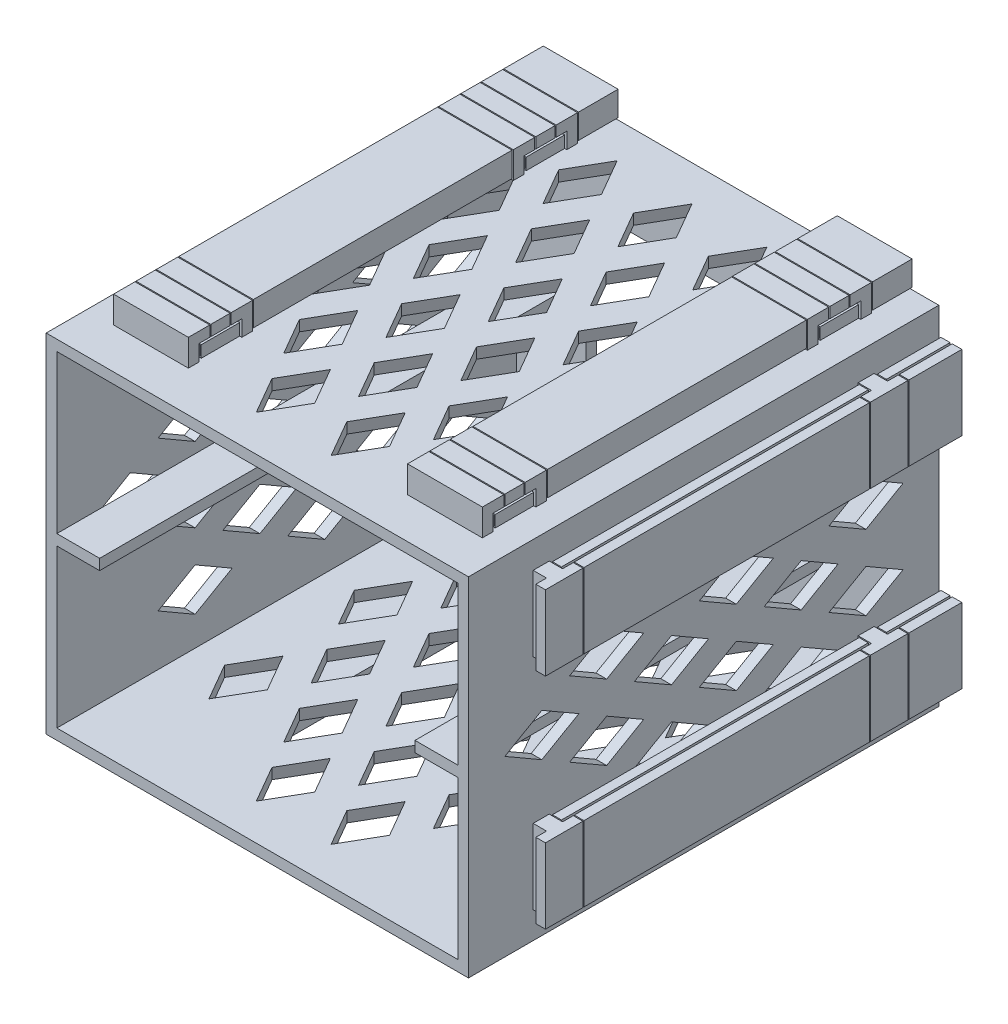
SolidWorks part; units mm, degrees
ref_plane "Alzado" through (0, 0, 0) normal (0, 0, 1) x (1, 0, 0)
ref_plane "Planta" through (0, 0, 0) normal (0, 1, 0) x (1, 0, 0)
ref_plane "Vista lateral" through (0, 0, 0) normal (1, 0, 0) x (0, 0, -1)
sketch "Croquis1" plane through (0, 0, 0) normal (0, 0, -1) x (-1, 0, 0)
  line L1 (-39.5, 32.5) -> (39.5, 32.5)
  line L2 (-39.5, 32.5) -> (-39.5, -32.5)
  line L3 (-39.5, -32.5) -> (39.5, -32.5)
  line L4 (39.5, 32.5) -> (39.5, -32.5)
  line L7 (-24.5, 17.5) -> (24.5, 17.5)
  line L8 (-24.5, 17.5) -> (-24.5, -17.5)
  line L9 (-24.5, -17.5) -> (24.5, -17.5)
  line L10 (24.5, 17.5) -> (24.5, -17.5)
extrude "Fondo" add sketch "Croquis1" against normal blind 2 separate body
sketch "Croquis3" plane through (0, 0, 2) normal (0, 0, 1) x (1, 0, 0)
  line L1 (-39.5, 32.5) -> (39.5, 32.5)
  line L2 (-39.5, 32.5) -> (-39.5, -32.5)
  line L3 (-39.5, -32.5) -> (39.5, -32.5)
  line L4 (39.5, 32.5) -> (39.5, -32.5)
  line L6 (-37.5, 30.5) -> (-37.5, -30.5)
  line L7 (-37.5, 30.5) -> (37.5, 30.5)
  line L8 (37.5, 30.5) -> (37.5, -30.5)
  line L9 (-37.5, -30.5) -> (37.5, -30.5)
extrude "Estructura" add sketch "Croquis3" along normal blind 86
sketch "Croquis5" plane through (-39.5, 0, 0) normal (-1, 0, 0) x (0, 0, 1)
  line L0 (13.628, 25) -> (20.556, 21)
  line L1 (20.556, 21) -> (13.628, 17)
  line L2 (13.628, 17) -> (6.7, 21)
  line L3 (6.7, 21) -> (13.628, 25)
  line L4 (0, -32.5) -> (0, 32.5) construction
  line L5 (88, 32.5) -> (0, 32.5) construction
  line L6 (13.628, 11) -> (20.556, 7)
  line L7 (6.7, 7) -> (13.628, 11)
  line L8 (13.628, 3) -> (6.7, 7)
  line L9 (20.556, 7) -> (13.628, 3)
  line L10 (13.628, -3) -> (20.556, -7)
  line L11 (6.7, -7) -> (13.628, -3)
  line L12 (13.628, -11) -> (6.7, -7)
  line L13 (20.556, -7) -> (13.628, -11)
  line L14 (13.628, -17) -> (20.556, -21)
  line L15 (6.7, -21) -> (13.628, -17)
  line L16 (13.628, -25) -> (6.7, -21)
  line L17 (20.556, -21) -> (13.628, -25)
  line L18 (37.884, 25) -> (44.812, 21)
  line L19 (44.812, 21) -> (37.884, 17)
  line L20 (37.884, 17) -> (30.956, 21)
  line L21 (30.956, 21) -> (37.884, 25)
  line L22 (44.812, 7) -> (37.884, 3)
  line L23 (37.884, 11) -> (44.812, 7)
  line L24 (30.956, 7) -> (37.884, 11)
  line L25 (37.884, 3) -> (30.956, 7)
  line L26 (44.812, -7) -> (37.884, -11)
  line L27 (37.884, -3) -> (44.812, -7)
  line L28 (30.956, -7) -> (37.884, -3)
  line L29 (37.884, -11) -> (30.956, -7)
  line L30 (37.884, -17) -> (44.812, -21)
  line L31 (44.812, -21) -> (37.884, -25)
  line L32 (37.884, -25) -> (30.956, -21)
  line L33 (30.956, -21) -> (37.884, -17)
  line L34 (62.14, 25) -> (69.068, 21)
  line L35 (69.068, 21) -> (62.14, 17)
  line L36 (62.14, 17) -> (55.212, 21)
  line L37 (55.212, 21) -> (62.14, 25)
  line L38 (69.068, 7) -> (62.14, 3)
  line L39 (62.14, 11) -> (69.068, 7)
  line L40 (55.212, 7) -> (62.14, 11)
  line L41 (62.14, 3) -> (55.212, 7)
  line L42 (69.068, -7) -> (62.14, -11)
  line L43 (62.14, -3) -> (69.068, -7)
  line L44 (55.212, -7) -> (62.14, -3)
  line L45 (62.14, -11) -> (55.212, -7)
  line L46 (62.14, -17) -> (69.068, -21)
  line L47 (69.068, -21) -> (62.14, -25)
  line L48 (62.14, -25) -> (55.212, -21)
  line L49 (55.212, -21) -> (62.14, -17)
  line L66 (50.012, 18) -> (56.94, 14)
  line L67 (56.94, 14) -> (50.012, 10)
  line L68 (50.012, 10) -> (43.084, 14)
  line L69 (43.084, 14) -> (50.012, 18)
  line L70 (50.012, 4) -> (56.94, 0)
  line L71 (43.084, 0) -> (50.012, 4)
  line L72 (50.012, -4) -> (43.084, 0)
  line L73 (56.94, -14) -> (50.012, -18)
  line L74 (50.012, -10) -> (56.94, -14)
  line L75 (43.084, -14) -> (50.012, -10)
  line L76 (18.828, 14) -> (25.756, 18)
  line L77 (67.34, 14) -> (74.268, 18) construction
  line L78 (67.34, -14) -> (74.268, -10) construction
  line L79 (74.268, -18) -> (67.34, -14) construction
  line L80 (25.756, 4) -> (32.684, 0)
  line L81 (18.828, 0) -> (25.756, 4)
  line L82 (25.756, -4) -> (18.828, 0)
  line L83 (32.684, 0) -> (25.756, -4)
  line L84 (25.756, -18) -> (18.828, -14)
  line L85 (32.684, -14) -> (25.756, -18)
  line L86 (56.94, 0) -> (50.012, -4)
  line L87 (50.012, -18) -> (43.084, -14)
  line L88 (32.684, 14) -> (25.756, 10)
  line L89 (25.756, 10) -> (18.828, 14)
  line L90 (25.756, 18) -> (32.684, 14)
  line L91 (74.268, 18) -> (81.196, 14) construction
  line L92 (81.196, 14) -> (74.268, 10) construction
  line L93 (74.268, 10) -> (67.34, 14) construction
  line L94 (81.196, 0) -> (74.268, -4)
  line L95 (74.268, 4) -> (81.196, 0)
  line L96 (67.34, 0) -> (74.268, 4)
  line L97 (74.268, -4) -> (67.34, 0)
  line L98 (81.196, -14) -> (74.268, -18) construction
  line L99 (74.268, -10) -> (81.196, -14) construction
  line L100 (25.756, -10) -> (32.684, -14)
  line L101 (18.828, -14) -> (25.756, -10)
  line L102 (88, 32.5) -> (0, 32.5) construction
  line L103 (86.396, 25) -> (93.324, 21)
  line L104 (93.324, 21) -> (86.396, 17)
  line L105 (86.396, 17) -> (79.468, 21)
  line L106 (79.468, 21) -> (86.396, 25)
  line L107 (93.324, 7) -> (86.396, 3)
  line L108 (86.396, 11) -> (93.324, 7)
  line L109 (79.468, 7) -> (86.396, 11)
  line L110 (86.396, 3) -> (79.468, 7)
  line L111 (93.324, -7) -> (86.396, -11)
  line L112 (86.396, -3) -> (93.324, -7)
  line L113 (79.468, -7) -> (86.396, -3)
  line L114 (86.396, -11) -> (79.468, -7)
  line L115 (86.396, -17) -> (93.324, -21)
  line L116 (93.324, -21) -> (86.396, -25)
  line L117 (86.396, -25) -> (79.468, -21)
  line L118 (79.468, -21) -> (86.396, -17)
  dimension "D1" = 7.9998
  dimension "D2" = 7.9998
  dimension "D3" = 6.7
  dimension "D4" = 7.5
  dimension "D5" = 8
  dimension "D7" = 13.856
  dimension "D9" = 24.256
  dimension "D10" = 14.5
  dimension "D11" = 24.256
  dimension "D6" = 4
  dimension "D8" = 4
extrude "RombosHor" cut sketch "Croquis5" against normal up to surface (79 mm away)
sketch "Croquis9" plane through (0, 32.5, 0) normal (0, 1, 0) x (1, 0, 0)
  line L0 (28, -6.6872) -> (24, -13.6154)
  line L1 (28, -6.6872) -> (32, -13.6154)
  line L2 (24, -13.6154) -> (28, -20.5436)
  line L3 (32, -13.6154) -> (28, -20.5436)
  line L4 (14, -6.6872) -> (10, -13.6154)
  line L5 (14, -6.6872) -> (18, -13.6154)
  line L6 (18, -13.6154) -> (14, -20.5436)
  line L7 (10, -13.6154) -> (14, -20.5436)
  line L8 (0, -6.6872) -> (-4, -13.6154)
  line L9 (0, -6.6872) -> (4, -13.6154)
  line L10 (4, -13.6154) -> (0, -20.5436)
  line L11 (-4, -13.6154) -> (0, -20.5436)
  line L12 (-14, -6.6872) -> (-18, -13.6154)
  line L13 (-14, -6.6872) -> (-10, -13.6154)
  line L14 (-10, -13.6154) -> (-14, -20.5436)
  line L15 (-18, -13.6154) -> (-14, -20.5436)
  line L16 (-28, -6.6872) -> (-32, -13.6154)
  line L17 (-28, -6.6872) -> (-24, -13.6154)
  line L18 (-24, -13.6154) -> (-28, -20.5436)
  line L19 (-32, -13.6154) -> (-28, -20.5436)
  line L20 (14, -30.9436) -> (10, -37.8718)
  line L21 (14, -30.9436) -> (18, -37.8718)
  line L22 (18, -37.8718) -> (14, -44.8)
  line L23 (10, -37.8718) -> (14, -44.8)
  line L24 (0, -30.9436) -> (-4, -37.8718)
  line L25 (0, -30.9436) -> (4, -37.8718)
  line L26 (4, -37.8718) -> (0, -44.8)
  line L27 (-4, -37.8718) -> (0, -44.8)
  line L28 (-14, -30.9436) -> (-18, -37.8718)
  line L29 (-14, -30.9436) -> (-10, -37.8718)
  line L30 (-10, -37.8718) -> (-14, -44.8)
  line L31 (-18, -37.8718) -> (-14, -44.8)
  line L32 (-28, -30.9436) -> (-32, -37.8718)
  line L33 (-28, -30.9436) -> (-24, -37.8718)
  line L34 (-24, -37.8718) -> (-28, -44.8)
  line L35 (-32, -37.8718) -> (-28, -44.8)
  line L36 (14, -55.2) -> (10, -62.1282)
  line L37 (14, -55.2) -> (18, -62.1282)
  line L38 (18, -62.1282) -> (14, -69.0564)
  line L39 (10, -62.1282) -> (14, -69.0564)
  line L40 (0, -55.2) -> (-4, -62.1282)
  line L41 (0, -55.2) -> (4, -62.1282)
  line L42 (4, -62.1282) -> (0, -69.0564)
  line L43 (-4, -62.1282) -> (0, -69.0564)
  line L44 (-14, -55.2) -> (-18, -62.1282)
  line L45 (-14, -55.2) -> (-10, -62.1282)
  line L46 (-10, -62.1282) -> (-14, -69.0564)
  line L47 (-18, -62.1282) -> (-14, -69.0564)
  line L48 (-28, -55.2) -> (-32, -62.1282)
  line L49 (-28, -55.2) -> (-24, -62.1282)
  line L50 (-24, -62.1282) -> (-28, -69.0564)
  line L51 (-32, -62.1282) -> (-28, -69.0564)
  line L68 (28, -30.9436) -> (24, -37.8718)
  line L69 (28, -30.9436) -> (32, -37.8718)
  line L70 (32, -37.8718) -> (28, -44.8)
  line L71 (24, -37.8718) -> (28, -44.8)
  line L72 (28, -55.2) -> (24, -62.1282)
  line L73 (28, -55.2) -> (32, -62.1282)
  line L74 (32, -62.1282) -> (28, -69.0564)
  line L75 (24, -62.1282) -> (28, -69.0564)
  line L80 (28, -6.6872) -> (14, -6.6872) construction
  line L81 (28, -6.6872) -> (28, -30.9436) construction
  line L83 (39.5, -88) -> (39.5, 0) construction
  line L87 (-39.5, 0) -> (39.5, 0) construction
  line L88 (17, -50.0018) -> (21, -56.93)
  line L89 (7, -67.33) -> (11, -74.2582)
  line L90 (-7, -67.33) -> (-11, -74.2582)
  line L91 (-7, -67.33) -> (-3, -74.2582)
  line L92 (-3, -74.2582) -> (-7, -81.1864)
  line L93 (-21, -67.33) -> (-25, -74.2582) construction
  line L94 (-21, -67.33) -> (-17, -74.2582) construction
  line L95 (-25, -74.2582) -> (-21, -81.1864) construction
  line L96 (21, -67.33) -> (25, -74.2582) construction
  line L97 (25, -74.2582) -> (21, -81.1864) construction
  line L98 (17, -74.2582) -> (21, -81.1864) construction
  line L99 (7, -18.8172) -> (3, -25.7454)
  line L100 (17, -25.7454) -> (21, -32.6736)
  line L101 (21, -18.8172) -> (25, -25.7454)
  line L102 (-7, -43.0736) -> (-11, -50.0018)
  line L103 (-3, -50.0018) -> (-7, -56.93)
  line L104 (-21, -43.0736) -> (-25, -50.0018)
  line L105 (-21, -43.0736) -> (-17, -50.0018)
  line L106 (-3, -25.7454) -> (-7, -32.6736)
  line L107 (-11, -25.7454) -> (-7, -32.6736)
  line L108 (-21, -18.8172) -> (-17, -25.7454)
  line L109 (-21, -18.8172) -> (-25, -25.7454)
  line L110 (-25, -25.7454) -> (-21, -32.6736)
  line L111 (21, -43.0736) -> (17, -50.0018)
  line L112 (11, -25.7454) -> (7, -32.6736)
  line L113 (7, -18.8172) -> (11, -25.7454)
  line L114 (7, -67.33) -> (3, -74.2582)
  line L115 (11, -74.2582) -> (7, -81.1864)
  line L116 (3, -74.2582) -> (7, -81.1864)
  line L117 (-11, -74.2582) -> (-7, -81.1864)
  line L118 (-17, -74.2582) -> (-21, -81.1864) construction
  line L119 (21, -67.33) -> (17, -74.2582) construction
  line L120 (7, -43.0736) -> (3, -50.0018)
  line L121 (7, -43.0736) -> (11, -50.0018)
  line L122 (11, -50.0018) -> (7, -56.93)
  line L123 (3, -50.0018) -> (7, -56.93)
  line L124 (21, -43.0736) -> (25, -50.0018)
  line L125 (25, -50.0018) -> (21, -56.93)
  line L126 (21, -18.8172) -> (17, -25.7454)
  line L127 (-7, -43.0736) -> (-3, -50.0018)
  line L128 (-11, -50.0018) -> (-7, -56.93)
  line L129 (-17, -50.0018) -> (-21, -56.93)
  line L130 (-25, -50.0018) -> (-21, -56.93)
  line L131 (-7, -18.8172) -> (-11, -25.7454)
  line L132 (-7, -18.8172) -> (-3, -25.7454)
  line L133 (-17, -25.7454) -> (-21, -32.6736)
  line L134 (3, -25.7454) -> (7, -32.6736)
  line L135 (25, -25.7454) -> (21, -32.6736)
  line L136 (18, -86.3846) -> (14, -93.3128)
  line L137 (10, -86.3846) -> (14, -93.3128)
  line L138 (4, -86.3846) -> (0, -93.3128)
  line L139 (-4, -86.3846) -> (0, -93.3128)
  line L140 (-10, -86.3846) -> (-14, -93.3128)
  line L141 (-18, -86.3846) -> (-14, -93.3128)
  line L142 (-24, -86.3846) -> (-28, -93.3128)
  line L143 (-32, -86.3846) -> (-28, -93.3128)
  line L144 (32, -86.3846) -> (28, -93.3128)
  line L145 (24, -86.3846) -> (28, -93.3128)
  line L146 (14, -79.4564) -> (10, -86.3846)
  line L147 (14, -79.4564) -> (18, -86.3846)
  line L148 (0, -79.4564) -> (-4, -86.3846)
  line L149 (0, -79.4564) -> (4, -86.3846)
  line L150 (-14, -79.4564) -> (-18, -86.3846)
  line L151 (-14, -79.4564) -> (-10, -86.3846)
  line L152 (-28, -79.4564) -> (-32, -86.3846)
  line L153 (-28, -79.4564) -> (-24, -86.3846)
  line L154 (28, -79.4564) -> (24, -86.3846)
  line L155 (28, -79.4564) -> (32, -86.3846)
  dimension "D1" = 8
  dimension "D2" = 8
  dimension "D3" = 8
  dimension "D4" = 13.8564
  dimension "D7" = 14
  dimension "D8" = 24.2564
  dimension "D9" = 6.6872
  dimension "D10" = 7.5
  dimension "D5" = 5
  dimension "D6" = 4
extrude "RombosVert" cut sketch "Croquis9" against normal up to surface (65 mm away)
sketch "Croquis8" plane through (0, 0, 2) normal (0, 0, 1) x (1, 0, 0)
  line L0 (-37.5, -30.5) -> (37.5, -30.5) construction
  line L1 (-29.5, -1) -> (-37.5, -1)
  line L2 (-29.5, -1) -> (-29.5, 1)
  line L3 (-29.5, 1) -> (-37.5, 1)
  line L4 (-37.5, -1) -> (-37.5, 1)
  line L5 (29.5, 1) -> (37.5, 1)
  line L6 (29.5, 1) -> (29.5, -1)
  line L7 (29.5, -1) -> (37.5, -1)
  line L8 (37.5, 1) -> (37.5, -1)
  dimension "D1" = 8
  dimension "D2" = 2
  dimension "D3" = 29.5
extrude "Guias" add sketch "Croquis8" along normal blind 86
sketch "Croquis10" plane through (39.5, 0, 0) normal (1, 0, 0) x (0, 0, -1)
  line L0 (-88, 32.5) -> (0, 32.5) construction
  line L1 (-12.104, -27.5) -> (-12.104, -13.5)
  line L2 (-15.104, -13.5) -> (-12.104, -13.5)
  line L3 (-15.104, -27.5) -> (-15.104, -13.5)
  line L4 (-15.104, -27.5) -> (-12.104, -27.5)
  line L5 (-88, 0) -> (0, 0) construction
  line L6 (-75.896, 27.5) -> (-75.896, 13.5)
  line L7 (-72.896, 13.5) -> (-75.896, 13.5)
  line L8 (-72.896, 27.5) -> (-72.896, 13.5)
  line L9 (0, 32.5) -> (0, -32.5) construction
  line L11 (-44, -32.5) -> (-44, 32.5) construction
  line L12 (-15.104, 27.5) -> (-12.104, 27.5)
  line L13 (-15.104, 27.5) -> (-15.104, 13.5)
  line L14 (-15.104, 13.5) -> (-12.104, 13.5)
  line L15 (-12.104, 27.5) -> (-12.104, 13.5)
  line L16 (-72.896, 27.5) -> (-75.896, 27.5)
  line L17 (-72.896, -27.5) -> (-75.896, -27.5)
  line L18 (-72.896, -27.5) -> (-72.896, -13.5)
  line L19 (-72.896, -13.5) -> (-75.896, -13.5)
  line L20 (-75.896, -27.5) -> (-75.896, -13.5)
  line L21 (-88, -32.5) -> (0, -32.5) construction
  dimension "D1" = 44
  dimension "D2" = 32.5
  dimension "D6" = 3
  dimension "D7" = 14
  dimension "D8" = 5
  dimension "D9" = 12.104
extrude "AncDer01" add sketch "Croquis10" along normal blind 2.5
sketch "Croquis11" plane through (42, 0, 0) normal (1, 0, 0) x (0, 0, -1)
  line L0 (-15.104, 13.5) -> (-12.104, 13.5) construction
  line L1 (0, 32.5) -> (0, -32.5) construction
  line L2 (-15.104, 27.5) -> (-15.104, 24.1478) construction
  line L3 (-17.104, 27.5) -> (-10.104, 27.5)
  line L4 (-17.104, 27.5) -> (-17.104, 13.5)
  line L5 (-44, 32.5) -> (-44, -32.5) construction
  line L6 (-12.104, 27.5) -> (-15.104, 27.5) construction
  line L7 (-10.104, -27.5) -> (-10.104, -13.5)
  line L8 (-17.104, 13.5) -> (-10.104, 13.5)
  line L9 (-17.104, -13.5) -> (-10.104, -13.5)
  line L10 (-88, 0) -> (0, 0) construction
  line L11 (-10.104, 27.5) -> (-10.104, 13.5)
  line L12 (-17.104, -27.5) -> (-17.104, -13.5)
  line L13 (-17.104, -27.5) -> (-10.104, -27.5)
  line L14 (-70.896, -27.5) -> (-77.896, -27.5)
  line L15 (-70.896, -27.5) -> (-70.896, -13.5)
  line L16 (-77.896, 27.5) -> (-77.896, 13.5)
  line L17 (-70.896, -13.5) -> (-77.896, -13.5)
  line L18 (-70.896, 13.5) -> (-77.896, 13.5)
  line L19 (-77.896, -27.5) -> (-77.896, -13.5)
  line L20 (-70.896, 27.5) -> (-70.896, 13.5)
  line L21 (-70.896, 27.5) -> (-77.896, 27.5)
  dimension "D1" = 44
  dimension "D2" = 88
  dimension "D3" = 7
  dimension "D4" = 2
extrude "AncDer02" add sketch "Croquis11" along normal blind 1.8
sketch "Croquis12" plane through (0, 32.5, 0) normal (0, 1, 0) x (1, 0, 0)
  line L1 (20.5, -9.604) -> (20.5, -7.604)
  line L2 (34.5, -7.604) -> (20.5, -7.604)
  line L3 (34.5, -9.604) -> (34.5, -7.604)
  line L4 (34.5, -9.604) -> (20.5, -9.604)
  line L5 (20.5, -19.604) -> (20.5, -17.604)
  line L6 (34.5, -17.604) -> (20.5, -17.604)
  line L7 (34.5, -19.604) -> (34.5, -17.604)
  line L8 (34.5, -19.604) -> (20.5, -19.604)
  line L10 (39.5, -44) -> (-39.5, -44) construction
  line L11 (-20.5, -78.396) -> (-20.5, -80.396)
  line L12 (-34.5, -80.396) -> (-20.5, -80.396)
  line L13 (0, -88) -> (0, 0) construction
  line L14 (-34.5, -78.396) -> (-34.5, -80.396)
  line L15 (-34.5, -78.396) -> (-20.5, -78.396)
  line L16 (-20.5, -68.396) -> (-20.5, -70.396)
  line L17 (-34.5, -70.396) -> (-20.5, -70.396)
  line L18 (-34.5, -68.396) -> (-34.5, -70.396)
  line L19 (-34.5, -68.396) -> (-20.5, -68.396)
  line L20 (34.5, -68.396) -> (20.5, -68.396)
  line L21 (-34.5, -19.604) -> (-20.5, -19.604)
  line L22 (-34.5, -19.604) -> (-34.5, -17.604)
  line L23 (-34.5, -17.604) -> (-20.5, -17.604)
  line L24 (-20.5, -19.604) -> (-20.5, -17.604)
  line L25 (-34.5, -9.604) -> (-20.5, -9.604)
  line L26 (-34.5, -9.604) -> (-34.5, -7.604)
  line L27 (-34.5, -7.604) -> (-20.5, -7.604)
  line L28 (-20.5, -9.604) -> (-20.5, -7.604)
  line L29 (34.5, -68.396) -> (34.5, -70.396)
  line L30 (34.5, -70.396) -> (20.5, -70.396)
  line L31 (20.5, -68.396) -> (20.5, -70.396)
  line L32 (34.5, -78.396) -> (20.5, -78.396)
  line L33 (34.5, -78.396) -> (34.5, -80.396)
  line L34 (34.5, -80.396) -> (20.5, -80.396)
  line L35 (20.5, -78.396) -> (20.5, -80.396)
  line L38 (-39.5, 0) -> (39.5, 0) construction
  line L39 (-39.5, -88) -> (-39.5, 0) construction
  dimension "D9" = 88
  dimension "D10" = 44
  dimension "D11" = 2
  dimension "D12" = 2
  dimension "D13" = 14
  dimension "D14" = 14
  dimension "D15" = 5
  dimension "D16" = 5
  dimension "D17" = 7.604
  dimension "D18" = 8
extrude "AncSup01" add sketch "Croquis12" along normal blind 3
sketch "Croquis13" plane through (0, 35.5, 0) normal (0, 1, 0) x (1, 0, 0)
  line L0 (39.5, -44) -> (-39.5, -44) construction
  line L2 (-39.5, 0) -> (39.5, 0) construction
  line L3 (-20.5, -9.604) -> (-20.5, -7.604) construction
  line L4 (-34.5, -7.604) -> (-20.5, -7.604)
  line L5 (-34.5, -7.604) -> (-34.5, -11.604)
  line L6 (-34.5, -11.604) -> (-20.5, -11.604)
  line L7 (-20.5, -7.604) -> (-20.5, -11.604)
  line L8 (-27.4575, -19.604) -> (-21.4543, -19.604) construction
  line L10 (-34.5, -19.604) -> (-20.5, -19.604)
  line L11 (0, 0) -> (0, -88) construction
  line L13 (-34.5, -19.604) -> (-34.5, -15.604)
  line L14 (-34.5, -15.604) -> (-20.5, -15.604)
  line L15 (-20.5, -19.604) -> (-20.5, -15.604)
  line L16 (-20.5, -19.604) -> (-20.5, -17.604) construction
  line L17 (20.5, -19.604) -> (20.5, -15.604)
  line L18 (34.5, -15.604) -> (20.5, -15.604)
  line L19 (34.5, -19.604) -> (34.5, -15.604)
  line L20 (34.5, -19.604) -> (20.5, -19.604)
  line L21 (20.5, -7.604) -> (20.5, -11.604)
  line L22 (34.5, -11.604) -> (20.5, -11.604)
  line L23 (34.5, -7.604) -> (34.5, -11.604)
  line L24 (34.5, -7.604) -> (20.5, -7.604)
  line L25 (34.5, -80.396) -> (20.5, -80.396)
  line L26 (34.5, -80.396) -> (34.5, -76.396)
  line L27 (34.5, -76.396) -> (20.5, -76.396)
  line L28 (20.5, -80.396) -> (20.5, -76.396)
  line L29 (34.5, -68.396) -> (20.5, -68.396)
  line L30 (34.5, -68.396) -> (34.5, -72.396)
  line L31 (34.5, -72.396) -> (20.5, -72.396)
  line L32 (20.5, -68.396) -> (20.5, -72.396)
  line L33 (-20.5, -68.396) -> (-20.5, -72.396)
  line L34 (-34.5, -72.396) -> (-20.5, -72.396)
  line L35 (-34.5, -68.396) -> (-34.5, -72.396)
  line L36 (-34.5, -68.396) -> (-20.5, -68.396)
  line L37 (-20.5, -80.396) -> (-20.5, -76.396)
  line L38 (-34.5, -76.396) -> (-20.5, -76.396)
  line L39 (-34.5, -80.396) -> (-34.5, -76.396)
  line L40 (-34.5, -80.396) -> (-20.5, -80.396)
  dimension "D1" = 44
  dimension "D2" = 88
  dimension "D3" = 4
  dimension "D4" = 4
extrude "AncSup02" add sketch "Croquis13" along normal blind 2
sketch "Croquis52" plane through (-39.5, 0, 0) normal (-1, 0, 0) x (0, 0, 1)
  line L0 (0, -32.5) -> (0, 32.5) construction
  line L1 (88, 32.5) -> (0, 32.5) construction
  line L2 (9.604, -27.5) -> (7.604, -27.5)
  line L3 (9.604, -27.5) -> (9.604, -13.5)
  line L4 (9.604, -13.5) -> (7.604, -13.5)
  line L5 (7.604, -27.5) -> (7.604, -13.5)
  line L6 (19.604, -27.5) -> (17.604, -27.5)
  line L7 (19.604, -27.5) -> (19.604, -13.5)
  line L8 (19.604, -13.5) -> (17.604, -13.5)
  line L9 (44, 32.5) -> (44, -32.5) construction
  line L10 (17.604, -27.5) -> (17.604, -13.5)
  line L11 (78.396, 27.5) -> (80.396, 27.5)
  line L12 (78.396, 27.5) -> (78.396, 13.5)
  line L13 (78.396, 13.5) -> (80.396, 13.5)
  line L14 (80.396, 27.5) -> (80.396, 13.5)
  line L15 (68.396, 27.5) -> (70.396, 27.5)
  line L16 (88, 0) -> (0, 0) construction
  line L17 (68.396, 27.5) -> (68.396, 13.5)
  line L18 (68.396, 13.5) -> (70.396, 13.5)
  line L19 (70.396, 27.5) -> (70.396, 13.5)
  line L20 (70.396, -27.5) -> (70.396, -13.5)
  line L21 (68.396, -13.5) -> (70.396, -13.5)
  line L22 (68.396, -27.5) -> (68.396, -13.5)
  line L23 (68.396, -27.5) -> (70.396, -27.5)
  line L24 (80.396, -27.5) -> (80.396, -13.5)
  line L25 (78.396, -13.5) -> (80.396, -13.5)
  line L26 (78.396, -27.5) -> (78.396, -13.5)
  line L27 (78.396, -27.5) -> (80.396, -27.5)
  line L32 (17.604, 27.5) -> (17.604, 13.5)
  line L33 (19.604, 13.5) -> (17.604, 13.5)
  line L34 (19.604, 27.5) -> (19.604, 13.5)
  line L35 (19.604, 27.5) -> (17.604, 27.5)
  line L36 (7.604, 27.5) -> (7.604, 13.5)
  line L37 (9.604, 13.5) -> (7.604, 13.5)
  line L38 (9.604, 27.5) -> (9.604, 13.5)
  line L39 (9.604, 27.5) -> (7.604, 27.5)
  dimension "D1" = 44
  dimension "D2" = 88
  dimension "D3" = 2
  dimension "D4" = 2
  dimension "D5" = 8
  dimension "D6" = 14
  dimension "D7" = 14
  dimension "D8" = 7.604
  dimension "D9" = 5
  dimension "D10" = 5
extrude "AncIzq01" [suppressed] add sketch "Croquis52" along normal blind 3
sketch "Croquis53" [suppressed] plane through (-42.5, 0, 0) normal (-1, 0, 0) x (0, 0, 1)
  line L0 (44, 32.5) -> (44, -32.5) construction
  line L1 (0, -32.5) -> (0, 32.5) construction
  line L2 (7.604, 13.5) -> (9.604, 13.5) construction
  line L3 (7.604, 27.5) -> (11.604, 27.5)
  line L4 (7.604, 27.5) -> (7.604, 13.5)
  line L5 (7.604, 13.5) -> (11.604, 13.5)
  line L6 (11.604, 27.5) -> (11.604, 13.5)
  line L7 (17.604, 13.5) -> (19.604, 13.5) construction
  line L8 (19.604, 27.5) -> (15.604, 27.5)
  line L10 (19.604, 27.5) -> (19.604, 13.5)
  line L12 (88, 0) -> (0, 0) construction
  line L13 (19.604, 13.5) -> (15.604, 13.5)
  line L14 (15.604, 27.5) -> (15.604, 13.5)
  line L15 (15.604, -27.5) -> (15.604, -13.5)
  line L16 (19.604, -13.5) -> (15.604, -13.5)
  line L17 (19.604, -27.5) -> (19.604, -13.5)
  line L18 (19.604, -27.5) -> (15.604, -27.5)
  line L19 (11.604, -27.5) -> (11.604, -13.5)
  line L20 (7.604, -13.5) -> (11.604, -13.5)
  line L21 (7.604, -27.5) -> (7.604, -13.5)
  line L22 (7.604, -27.5) -> (11.604, -27.5)
  line L23 (80.396, -27.5) -> (76.396, -27.5)
  line L24 (80.396, -27.5) -> (80.396, -13.5)
  line L25 (80.396, -13.5) -> (76.396, -13.5)
  line L26 (76.396, -27.5) -> (76.396, -13.5)
  line L27 (68.396, -27.5) -> (72.396, -27.5)
  line L28 (68.396, -27.5) -> (68.396, -13.5)
  line L29 (68.396, -13.5) -> (72.396, -13.5)
  line L30 (72.396, -27.5) -> (72.396, -13.5)
  line L31 (72.396, 27.5) -> (72.396, 13.5)
  line L32 (68.396, 13.5) -> (72.396, 13.5)
  line L33 (68.396, 27.5) -> (68.396, 13.5)
  line L34 (68.396, 27.5) -> (72.396, 27.5)
  line L35 (76.396, 27.5) -> (76.396, 13.5)
  line L36 (80.396, 13.5) -> (76.396, 13.5)
  line L37 (80.396, 27.5) -> (80.396, 13.5)
  line L38 (80.396, 27.5) -> (76.396, 27.5)
  dimension "D1" = 44
  dimension "D2" = 88
  dimension "D3" = 4
  dimension "D4" = 4
extrude "AncIzq02" [suppressed] add sketch "Croquis53" along normal blind 2
sketch "Croquis54" plane through (0, -32.5, 0) normal (0, -1, 0) x (1, 0, 0)
  line L0 (0, 88) -> (0, 0) construction
  line L1 (-34.5, 15.104) -> (-20.5, 15.104)
  line L2 (-34.5, 15.104) -> (-34.5, 12.104)
  line L3 (-34.5, 12.104) -> (-20.5, 12.104)
  line L4 (-20.5, 15.104) -> (-20.5, 12.104)
  line L5 (-39.5, 88) -> (39.5, 88) construction
  line L6 (-39.5, 44) -> (39.5, 44) construction
  line L7 (-39.5, 88) -> (-39.5, 0) construction
  line L8 (39.5, 88) -> (39.5, 0) construction
  line L9 (39.5, 0) -> (-39.5, 0) construction
  line L10 (20.5, 15.104) -> (20.5, 12.104)
  line L11 (34.5, 12.104) -> (20.5, 12.104)
  line L12 (34.5, 15.104) -> (34.5, 12.104)
  line L13 (34.5, 15.104) -> (20.5, 15.104)
  line L14 (34.5, 72.896) -> (20.5, 72.896)
  line L15 (34.5, 72.896) -> (34.5, 75.896)
  line L16 (34.5, 75.896) -> (20.5, 75.896)
  line L17 (20.5, 72.896) -> (20.5, 75.896)
  line L18 (-20.5, 72.896) -> (-20.5, 75.896)
  line L19 (-34.5, 75.896) -> (-20.5, 75.896)
  line L20 (-34.5, 72.896) -> (-34.5, 75.896)
  line L21 (-34.5, 72.896) -> (-20.5, 72.896)
  dimension "D1" = 3
  dimension "D2" = 14
  dimension "D3" = 5
  dimension "D4" = 12.104
extrude "AncInf01" add sketch "Croquis54" along normal blind 2.5
sketch "Croquis55" plane through (0, -35, 0) normal (0, -1, 0) x (1, 0, 0)
  line L1 (-34.5, 77.896) -> (-20.5, 77.896)
  line L2 (-34.5, 77.896) -> (-34.5, 70.896)
  line L3 (-34.5, 70.896) -> (-20.5, 70.896)
  line L4 (-20.5, 77.896) -> (-20.5, 70.896)
  line L6 (-20.5, 72.896) -> (-20.5, 75.896) construction
  line L7 (-34.5, 75.896) -> (-34.5, 72.896) construction
  line L8 (-34.5, 72.896) -> (-20.5, 72.896) construction
  line L9 (-39.5, 44) -> (39.5, 44) construction
  line L10 (-39.5, 88) -> (-39.5, 0) construction
  line L11 (39.5, 88) -> (39.5, 0) construction
  line L12 (0, 88) -> (0, 0) construction
  line L13 (-39.5, 88) -> (39.5, 88) construction
  line L14 (20.5, 77.896) -> (20.5, 70.896)
  line L15 (34.5, 70.896) -> (20.5, 70.896)
  line L16 (34.5, 77.896) -> (34.5, 70.896)
  line L17 (34.5, 77.896) -> (20.5, 77.896)
  line L18 (34.5, 10.104) -> (20.5, 10.104)
  line L19 (34.5, 10.104) -> (34.5, 17.104)
  line L20 (34.5, 17.104) -> (20.5, 17.104)
  line L21 (20.5, 10.104) -> (20.5, 17.104)
  line L22 (-20.5, 10.104) -> (-20.5, 17.104)
  line L23 (-34.5, 17.104) -> (-20.5, 17.104)
  line L24 (-34.5, 10.104) -> (-34.5, 17.104)
  line L25 (-34.5, 10.104) -> (-20.5, 10.104)
  dimension "D1" = 7
  dimension "D2" = 2
extrude "AncInf02" add sketch "Croquis55" along normal blind 1.8
sketch "Croquis61" plane through (0, 0, 0) normal (0, 0, -1) x (-1, 0, 0)
  line L1 (20.5, 32.9) -> (34.5, 32.9)
  line L2 (20.5, 32.9) -> (20.5, 37.5)
  line L3 (20.5, 37.5) -> (34.5, 37.5)
  line L4 (34.5, 32.9) -> (34.5, 37.5)
  line L5 (20.7, 33.1) -> (20.7, 37.3)
  line L6 (20.7, 37.3) -> (34.3, 37.3)
  line L7 (34.3, 33.1) -> (34.3, 37.3)
  line L8 (20.7, 33.1) -> (34.3, 33.1)
  line L9 (0, 32.5) -> (0, 17.5) construction
  line L10 (39.5, 32.5) -> (-39.5, 32.5) construction
  line L11 (24.5, 17.5) -> (-24.5, 17.5) construction
  line L12 (-20.7, 33.1) -> (-34.3, 33.1)
  line L13 (-34.3, 33.1) -> (-34.3, 37.3)
  line L14 (-20.7, 37.3) -> (-34.3, 37.3)
  line L15 (-20.7, 33.1) -> (-20.7, 37.3)
  line L16 (-34.5, 32.9) -> (-34.5, 37.5)
  line L17 (-20.5, 37.5) -> (-34.5, 37.5)
  line L18 (-20.5, 32.9) -> (-20.5, 37.5)
  line L19 (-20.5, 32.9) -> (-34.5, 32.9)
  dimension "D1" = 0.2
extrude "EspAncSup01" add sketch "Croquis61" against normal blind 7.404 separate body
ref_plane "PlanoEspAncSup01" through (0, 0, 19.804) normal (0, 0, 1) x (1, 0, 0)
sketch "Croquis57" plane through (0, 0, 19.804) normal (0, 0, 1) x (1, 0, 0)
  line L1 (34.5, 37.5) -> (20.5457, 37.5)
  line L2 (34.5, 37.5) -> (34.5, 32.9)
  line L3 (34.5, 32.9) -> (20.5457, 32.9)
  line L4 (20.5457, 37.5) -> (20.5457, 32.9)
  line L5 (34.3, 37.3) -> (34.3, 33.1)
  line L6 (34.3, 33.1) -> (20.7457, 33.1)
  line L7 (20.7457, 37.3) -> (20.7457, 33.1)
  line L8 (34.3, 37.3) -> (20.7457, 37.3)
  line L9 (0, 32.5) -> (0, 17.5) construction
  line L10 (-24.5, 17.5) -> (24.5, 17.5) construction
  line L11 (-34.3, 37.3) -> (-20.7457, 37.3)
  line L12 (-20.7457, 37.3) -> (-20.7457, 33.1)
  line L13 (-34.3, 33.1) -> (-20.7457, 33.1)
  line L14 (-34.3, 37.3) -> (-34.3, 33.1)
  line L15 (-20.5457, 37.5) -> (-20.5457, 32.9)
  line L16 (-34.5, 32.9) -> (-20.5457, 32.9)
  line L17 (-34.5, 37.5) -> (-34.5, 32.9)
  line L18 (-34.5, 37.5) -> (-20.5457, 37.5)
  dimension "D1" = 0.2
sketch "Croquis58" plane through (0, 0, 19.804) normal (0, 0, 1) x (1, 0, 0)
  line L0 (33.8, 36.8) -> (33.8, 33.6)
  line L1 (0, 32.5) -> (0, 17.5) construction
  line L2 (-33.6, 36.6) -> (-21.4457, 36.6)
  line L3 (-21.4457, 36.6) -> (-21.4457, 33.8)
  line L4 (-33.6, 33.8) -> (-21.4457, 33.8)
  line L5 (33.8, 33.6) -> (21.2457, 33.6)
  line L6 (21.2457, 36.8) -> (21.2457, 33.6)
  line L7 (33.8, 36.8) -> (21.2457, 36.8)
  line L8 (33.6, 36.6) -> (33.6, 33.8)
  line L9 (33.6, 33.8) -> (21.4457, 33.8)
  line L10 (21.4457, 36.6) -> (21.4457, 33.8)
  line L11 (33.6, 36.6) -> (21.4457, 36.6)
  line L12 (-33.6, 36.6) -> (-33.6, 33.8)
  line L13 (-33.8, 36.8) -> (-21.2457, 36.8)
  line L14 (-21.2457, 36.8) -> (-21.2457, 33.6)
  line L15 (-33.8, 33.6) -> (-21.2457, 33.6)
  line L16 (-33.8, 36.8) -> (-33.8, 33.6)
  dimension "D2" = 0.2
sketch "Croquis59" plane through (0, 0, 19.804) normal (0, 0, 1) x (1, 0, 0)
  line L0 (33.1, 36.1) -> (33.1, 34.3)
  line L1 (0, 32.5) -> (0, 17.5) construction
  line L2 (-32.9, 35.9) -> (-22.1457, 35.9)
  line L3 (-22.1457, 35.9) -> (-22.1457, 34.5)
  line L4 (-32.9, 34.5) -> (-22.1457, 34.5)
  line L5 (33.1, 34.3) -> (21.9457, 34.3)
  line L6 (21.9457, 36.1) -> (21.9457, 34.3)
  line L7 (33.1, 36.1) -> (21.9457, 36.1)
  line L8 (32.9, 35.9) -> (32.9, 34.5)
  line L9 (32.9, 34.5) -> (22.1457, 34.5)
  line L10 (22.1457, 35.9) -> (22.1457, 34.5)
  line L11 (32.9, 35.9) -> (22.1457, 35.9)
  line L12 (-32.9, 35.9) -> (-32.9, 34.5)
  line L13 (-33.1, 36.1) -> (-21.9457, 36.1)
  line L14 (-21.9457, 36.1) -> (-21.9457, 34.3)
  line L15 (-33.1, 34.3) -> (-21.9457, 34.3)
  line L16 (-33.1, 36.1) -> (-33.1, 34.3)
  dimension "D2" = 0.2
extrude "EspAncSup02" add sketch "Croquis57" along normal blind 48.392
extrude "EspAncSup03" add sketch "Croquis58" along normal blind 48.392 separate body
extrude "EspAncSup04" add sketch "Croquis59" along normal blind 48.392 separate body
ref_plane "PlanoEspAncSup02" through (0, 32.9, 0) normal (0, 1, 0) x (1, 0, 0)
sketch "Croquis64" plane through (0, 32.9, 0) normal (0, 1, 0) x (1, 0, 0)
  line L0 (-34.5, -9.604) -> (-29.684, -9.604) construction
  line L1 (-20.5, -17.204) -> (-34.5, -17.204)
  line L2 (-20.5, -17.204) -> (-20.5, -10.004)
  line L3 (-20.5, -10.004) -> (-34.5, -10.004)
  line L4 (-34.5, -17.204) -> (-34.5, -10.004)
  line L5 (-29.6972, -17.604) -> (-34.5, -17.604) construction
  line L6 (-34.5, -7.604) -> (-34.5, -9.604) construction
  line L7 (-39.5, -44) -> (39.5, -44) construction
  line L8 (-39.5, -88) -> (-39.5, 0) construction
  line L9 (39.5, -88) -> (39.5, 0) construction
  line L10 (0, 0) -> (0, -88) construction
  line L11 (39.5, -88) -> (-39.5, -88) construction
  line L12 (34.5, -17.204) -> (34.5, -10.004)
  line L13 (20.5, -10.004) -> (34.5, -10.004)
  line L14 (20.5, -17.204) -> (20.5, -10.004)
  line L15 (20.5, -17.204) -> (34.5, -17.204)
  line L16 (20.5, -70.796) -> (34.5, -70.796)
  line L17 (20.5, -70.796) -> (20.5, -77.996)
  line L18 (20.5, -77.996) -> (34.5, -77.996)
  line L19 (34.5, -70.796) -> (34.5, -77.996)
  line L20 (-34.5, -70.796) -> (-34.5, -77.996)
  line L21 (-20.5, -77.996) -> (-34.5, -77.996)
  line L22 (-20.5, -70.796) -> (-20.5, -77.996)
  line L23 (-20.5, -70.796) -> (-34.5, -70.796)
  dimension "D1" = 0.4
  dimension "D2" = 0.4
  dimension "D3" = 14
extrude "EspAncSup05" add sketch "Croquis64" along normal blind 2.2
sketch "Croquis66" plane through (0, 0, 17.204) normal (0, 0, 1) x (1, 0, 0)
  line L0 (-34.3, 34.9) -> (-34.3, 33.1)
  line L1 (0, 17.5) -> (0, 30.5) construction
  line L2 (-24.5, 17.5) -> (24.5, 17.5) construction
  line L3 (37.5, 30.5) -> (-37.5, 30.5) construction
  line L4 (34.3, 34.9) -> (20.7, 34.9)
  line L5 (-34.3, 33.1) -> (-20.7, 33.1)
  line L6 (-20.7, 34.9) -> (-20.7, 33.1)
  line L7 (-34.3, 34.9) -> (-20.7, 34.9)
  line L8 (20.7, 34.9) -> (20.7, 33.1)
  line L9 (34.3, 33.1) -> (20.7, 33.1)
  line L10 (34.3, 34.9) -> (34.3, 33.1)
extrude "EspAncSup06" cut sketch "Croquis66" against normal up to next (7.2 mm away)
sketch "Croquis68" plane through (0, 0, 77.996) normal (0, 0, 1) x (1, 0, 0)
  line L0 (34.3, 34.9) -> (34.3, 33.1)
  line L1 (0, 17.5) -> (0, 32.5) construction
  line L2 (-24.5, 17.5) -> (24.5, 17.5) construction
  line L3 (-34.3, 34.9) -> (-20.7, 34.9)
  line L4 (-20.7, 34.9) -> (-20.7, 33.1)
  line L5 (34.3, 33.1) -> (20.7, 33.1)
  line L6 (20.7, 34.9) -> (20.7, 33.1)
  line L7 (34.3, 34.9) -> (20.7, 34.9)
  line L8 (-34.3, 33.1) -> (-20.7, 33.1)
  line L9 (-34.3, 34.9) -> (-34.3, 33.1)
extrude "EspAncSup07" cut sketch "Croquis68" against normal up to next (7.2 mm away)
sketch "Croquis70" plane through (0, 35.5, 0) normal (0, -1, 0) x (1, 0, 0)
  line L1 (20.5, 70.396) -> (20.5, 72.396) construction
  line L2 (20.5, 72.396) -> (34.5, 72.396) construction
  line L3 (34.5, 76.396) -> (20.5, 76.396) construction
  line L4 (34.5, 72.396) -> (34.5, 70.396) construction
  line L5 (-34.5, 76.196) -> (-34.5, 72.596)
  line L6 (-20.5, 72.596) -> (-34.5, 72.596)
  line L7 (-20.5, 76.196) -> (-20.5, 72.596)
  line L8 (0, 88) -> (0, 0) construction
  line L9 (39.5, 88) -> (-39.5, 88) construction
  line L10 (39.5, 44) -> (-39.5, 44) construction
  line L11 (39.5, 88) -> (39.5, 0) construction
  line L12 (-39.5, 88) -> (-39.5, 0) construction
  line L13 (-20.5, 76.196) -> (-34.5, 76.196)
  line L14 (34.5, 11.804) -> (34.5, 15.404)
  line L15 (20.5, 15.404) -> (34.5, 15.404)
  line L16 (20.5, 11.804) -> (20.5, 15.404)
  line L17 (20.5, 76.196) -> (34.5, 76.196)
  line L18 (20.5, 76.196) -> (20.5, 72.596)
  line L19 (20.5, 72.596) -> (34.5, 72.596)
  line L20 (34.5, 76.196) -> (34.5, 72.596)
  line L21 (20.5, 11.804) -> (34.5, 11.804)
  line L22 (-20.5, 11.804) -> (-34.5, 11.804)
  line L23 (-20.5, 11.804) -> (-20.5, 15.404)
  line L24 (-20.5, 15.404) -> (-34.5, 15.404)
  line L25 (-34.5, 11.804) -> (-34.5, 15.404)
  dimension "D1" = 0.2
  dimension "D2" = 0.2
extrude "EspAncSup08" add sketch "Croquis70" against normal blind 2 separate body
sketch "Croquis71" plane through (0, 0, 72.596) normal (0, 0, -1) x (-1, 0, 0)
  line L0 (-34.3, 37.3) -> (-34.3, 35.7)
  line L2 (0, 32.5) -> (0, 17.5) construction
  line L3 (39.5, 32.5) -> (-39.5, 32.5) construction
  line L4 (24.5, 17.5) -> (-24.5, 17.5) construction
  line L5 (-20.7, 35.7) -> (-34.3, 35.7)
  line L6 (-20.7, 37.3) -> (-20.7, 35.7)
  line L7 (-20.7, 37.3) -> (-34.3, 37.3)
  line L8 (20.7, 37.3) -> (34.3, 37.3)
  line L9 (20.7, 37.3) -> (20.7, 35.7)
  line L10 (20.7, 35.7) -> (34.3, 35.7)
  line L11 (34.3, 37.3) -> (34.3, 35.7)
extrude "EspAncSup09" cut sketch "Croquis71" against normal up to next (3.6 mm away)
sketch "Croquis72" plane through (0, 0, 11.804) normal (0, 0, -1) x (-1, 0, 0)
  line L0 (-34.3, 37.3) -> (-34.3, 35.7)
  line L1 (0, 32.5) -> (0, 17.5) construction
  line L2 (39.5, 32.5) -> (-39.5, 32.5) construction
  line L3 (24.5, 17.5) -> (-24.5, 17.5) construction
  line L4 (34.3, 37.3) -> (20.7, 37.3)
  line L5 (-34.3, 35.7) -> (-20.7, 35.7)
  line L6 (-20.7, 37.3) -> (-20.7, 35.7)
  line L7 (-34.3, 37.3) -> (-20.7, 37.3)
  line L8 (20.7, 37.3) -> (20.7, 35.7)
  line L9 (34.3, 35.7) -> (20.7, 35.7)
  line L10 (34.3, 37.3) -> (34.3, 35.7)
extrude "EspAncSup10" cut sketch "Croquis72" against normal up to next (3.6 mm away)
sketch "Croquis73" plane through (0, 0, 0) normal (0, 0, -1) x (-1, 0, 0)
  line L1 (39.9, 27.5) -> (44.5, 27.5)
  line L2 (39.9, 27.5) -> (39.9, 13.5)
  line L3 (39.9, 13.5) -> (44.5, 13.5)
  line L4 (44.5, 27.5) -> (44.5, 13.5)
  line L6 (39.5, 0) -> (24.5, 0) construction
  line L7 (39.5, -32.5) -> (39.5, 32.5) construction
  line L8 (24.5, -17.5) -> (24.5, 17.5) construction
  line L9 (40.1, -27.3) -> (40.1, -13.7)
  line L10 (40.1, -13.7) -> (44.3, -13.7)
  line L11 (44.3, -27.3) -> (44.3, -13.7)
  line L12 (40.1, -27.3) -> (44.3, -27.3)
  line L13 (40.1, 27.3) -> (44.3, 27.3)
  line L14 (44.3, 27.3) -> (44.3, 13.7)
  line L15 (40.1, 13.7) -> (44.3, 13.7)
  line L16 (40.1, 27.3) -> (40.1, 13.7)
  line L17 (44.5, -27.5) -> (44.5, -13.5)
  line L18 (39.9, -13.5) -> (44.5, -13.5)
  line L19 (39.9, -27.5) -> (39.9, -13.5)
  line L20 (39.9, -27.5) -> (44.5, -27.5)
  dimension "D1" = 0.2
extrude "EspAncIzq01" [suppressed] add sketch "Croquis73" against normal blind 7.404 separate body
sketch "Croquis74" plane through (0, 0, 19.804) normal (0, 0, 1) x (1, 0, 0)
  line L1 (-39.9, 27.5) -> (-44.5, 27.5)
  line L2 (-39.9, 27.5) -> (-39.9, 13.5)
  line L3 (-39.9, 13.5) -> (-44.5, 13.5)
  line L4 (-44.5, 27.5) -> (-44.5, 13.5)
  line L5 (-40.1, 27.3) -> (-44.3, 27.3)
  line L6 (-44.3, 27.3) -> (-44.3, 13.7)
  line L7 (-40.1, 13.7) -> (-44.3, 13.7)
  line L8 (-40.1, 27.3) -> (-40.1, 13.7)
  line L9 (-39.5, 0) -> (-24.5, 0) construction
  line L10 (-39.5, 32.5) -> (-39.5, -32.5) construction
  line L11 (-24.5, -17.5) -> (-24.5, 17.5) construction
  line L12 (-40.1, -27.3) -> (-40.1, -13.7)
  line L13 (-40.1, -13.7) -> (-44.3, -13.7)
  line L14 (-44.3, -27.3) -> (-44.3, -13.7)
  line L15 (-40.1, -27.3) -> (-44.3, -27.3)
  line L16 (-44.5, -27.5) -> (-44.5, -13.5)
  line L17 (-39.9, -13.5) -> (-44.5, -13.5)
  line L18 (-39.9, -27.5) -> (-39.9, -13.5)
  line L19 (-39.9, -27.5) -> (-44.5, -27.5)
  dimension "D1" = 0.2
sketch "Croquis75" plane through (0, 0, 19.804) normal (0, 0, 1) x (1, 0, 0)
  line L0 (-40.6, 26.8) -> (-40.6, 14.2)
  line L1 (-39.5, 0) -> (-24.5, 0) construction
  line L2 (-40.8, -26.6) -> (-40.8, -14.4)
  line L3 (-40.8, -14.4) -> (-43.6, -14.4)
  line L4 (-43.6, -26.6) -> (-43.6, -14.4)
  line L5 (-40.6, 14.2) -> (-43.8, 14.2)
  line L6 (-43.8, 26.8) -> (-43.8, 14.2)
  line L7 (-40.6, 26.8) -> (-43.8, 26.8)
  line L8 (-40.8, 26.6) -> (-43.6, 26.6)
  line L9 (-43.6, 26.6) -> (-43.6, 14.4)
  line L10 (-40.8, 14.4) -> (-43.6, 14.4)
  line L11 (-40.8, 26.6) -> (-40.8, 14.4)
  line L12 (-40.8, -26.6) -> (-43.6, -26.6)
  line L13 (-40.6, -26.8) -> (-43.8, -26.8)
  line L14 (-43.8, -26.8) -> (-43.8, -14.2)
  line L15 (-40.6, -14.2) -> (-43.8, -14.2)
  line L16 (-40.6, -26.8) -> (-40.6, -14.2)
  dimension "D2" = 0.2
sketch "Croquis76" plane through (0, 0, 19.804) normal (0, 0, 1) x (1, 0, 0)
  line L0 (-41.3, 26.1) -> (-41.3, 14.9)
  line L1 (-39.5, 0) -> (-24.5, 0) construction
  line L2 (-41.5, -25.9) -> (-42.9, -25.9)
  line L3 (-42.9, -25.9) -> (-42.9, -15.1)
  line L4 (-41.5, -15.1) -> (-42.9, -15.1)
  line L5 (-41.3, 14.9) -> (-43.1, 14.9)
  line L6 (-43.1, 26.1) -> (-43.1, 14.9)
  line L7 (-41.3, 26.1) -> (-43.1, 26.1)
  line L8 (-41.5, 25.9) -> (-41.5, 15.1)
  line L9 (-41.5, 15.1) -> (-42.9, 15.1)
  line L10 (-42.9, 25.9) -> (-42.9, 15.1)
  line L11 (-41.5, 25.9) -> (-42.9, 25.9)
  line L12 (-41.5, -25.9) -> (-41.5, -15.1)
  line L13 (-41.3, -26.1) -> (-43.1, -26.1)
  line L14 (-43.1, -26.1) -> (-43.1, -14.9)
  line L15 (-41.3, -14.9) -> (-43.1, -14.9)
  line L16 (-41.3, -26.1) -> (-41.3, -14.9)
  dimension "D2" = 0.2
extrude "EspAncIzq02" [suppressed] add sketch "Croquis74" along normal blind 48.392 separate body
extrude "EspAncIzq03" [suppressed] add sketch "Croquis75" along normal blind 48.392 separate body
extrude "EspAncIzq04" [suppressed] add sketch "Croquis76" along normal blind 48.392 separate body
ref_plane "PlanoEspAncIzq01" [suppressed] through (-39.9, 0, 0) normal (-1, 0, 0) x (0, 0, 1)
sketch "Croquis77" [suppressed] plane through (-39.9, 0, 0) normal (-1, 0, 0) x (0, 0, 1)
  line L1 (9.804, 13.5) -> (17.404, 13.5)
  line L2 (9.804, 13.5) -> (9.804, 27.5)
  line L3 (9.804, 27.5) -> (17.404, 27.5)
  line L4 (17.404, 13.5) -> (17.404, 27.5)
  line L5 (19.604, 27.5) -> (17.604, 27.5) construction
  line L7 (7.604, 13.5) -> (9.604, 13.5) construction
  line L8 (44, 32.5) -> (44, -32.5) construction
  line L9 (88, 32.5) -> (0, 32.5) construction
  line L10 (88, -32.5) -> (0, -32.5) construction
  line L11 (88, 0) -> (0, 0) construction
  line L12 (88, 32.5) -> (88, -32.5) construction
  line L13 (0, -32.5) -> (0, 32.5) construction
  line L14 (70.596, 13.5) -> (70.596, 27.5)
  line L15 (78.196, 27.5) -> (70.596, 27.5)
  line L16 (78.196, 13.5) -> (78.196, 27.5)
  line L17 (78.196, 13.5) -> (70.596, 13.5)
  line L18 (78.196, -13.5) -> (70.596, -13.5)
  line L19 (78.196, -13.5) -> (78.196, -27.5)
  line L20 (78.196, -27.5) -> (70.596, -27.5)
  line L21 (70.596, -13.5) -> (70.596, -27.5)
  line L22 (17.404, -13.5) -> (17.404, -27.5)
  line L23 (9.804, -27.5) -> (17.404, -27.5)
  line L24 (9.804, -13.5) -> (9.804, -27.5)
  line L25 (9.804, -13.5) -> (17.404, -13.5)
extrude "EspAncIzq05" [suppressed] add sketch "Croquis77" along normal blind 2.2
sketch "Croquis78" [suppressed] plane through (0, 0, 9.804) normal (0, 0, -1) x (-1, 0, 0)
  line L0 (41.9, 13.7) -> (41.9, 27.3)
  line L1 (39.5, 0) -> (24.5, 0) construction
  line L2 (24.5, -17.5) -> (24.5, 17.5) construction
  line L3 (41.9, -13.7) -> (40.1, -13.7)
  line L4 (40.1, -13.7) -> (40.1, -27.3)
  line L5 (41.9, 27.3) -> (40.1, 27.3)
  line L6 (40.1, 13.7) -> (40.1, 27.3)
  line L7 (41.9, 13.7) -> (40.1, 13.7)
  line L8 (41.9, -27.3) -> (40.1, -27.3)
  line L9 (41.9, -13.7) -> (41.9, -27.3)
extrude "EspAncIzq06" [suppressed] cut sketch "Croquis78" against normal up to next
sketch "Croquis79" [suppressed] plane through (0, 0, 70.596) normal (0, 0, -1) x (-1, 0, 0)
  line L0 (40.1, 27.3) -> (40.1, 13.7)
  line L1 (39.5, 0) -> (24.5, 0) construction
  line L2 (39.5, -32.5) -> (39.5, 32.5) construction
  line L3 (24.5, -17.5) -> (24.5, 17.5) construction
  line L4 (40.1, -27.3) -> (41.9, -27.3)
  line L5 (40.1, 13.7) -> (41.9, 13.7)
  line L6 (41.9, 27.3) -> (41.9, 13.7)
  line L7 (40.1, 27.3) -> (41.9, 27.3)
  line L8 (41.9, -27.3) -> (41.9, -13.7)
  line L9 (40.1, -13.7) -> (41.9, -13.7)
  line L10 (40.1, -27.3) -> (40.1, -13.7)
extrude "EspAncIzq07" [suppressed] cut sketch "Croquis79" against normal up to next
sketch "Croquis80" [suppressed] plane through (-42.5, 0, 0) normal (1, 0, 0) x (0, 0, -1)
  line L1 (-15.404, -13.5) -> (-11.804, -13.5)
  line L2 (-15.404, -13.5) -> (-15.404, -27.5)
  line L3 (-15.404, -27.5) -> (-11.804, -27.5)
  line L4 (-11.804, -13.5) -> (-11.804, -27.5)
  line L5 (-11.604, -27.5) -> (-11.604, -13.5) construction
  line L6 (-9.604, -27.5) -> (-11.604, -27.5) construction
  line L8 (-17.604, -13.5) -> (-15.604, -13.5) construction
  line L9 (-15.604, -13.5) -> (-15.604, -27.5) construction
  line L10 (-44, -32.5) -> (-44, 32.5) construction
  line L11 (-88, -32.5) -> (0, -32.5) construction
  line L12 (-88, 32.5) -> (0, 32.5) construction
  line L13 (0, 0) -> (-88, 0) construction
  line L14 (-88, 32.5) -> (-88, -32.5) construction
  line L15 (-76.196, -13.5) -> (-76.196, -27.5)
  line L16 (-72.596, -27.5) -> (-76.196, -27.5)
  line L17 (-72.596, -13.5) -> (-72.596, -27.5)
  line L18 (-72.596, -13.5) -> (-76.196, -13.5)
  line L19 (-72.596, 13.5) -> (-76.196, 13.5)
  line L20 (-72.596, 13.5) -> (-72.596, 27.5)
  line L21 (-72.596, 27.5) -> (-76.196, 27.5)
  line L22 (-76.196, 13.5) -> (-76.196, 27.5)
  line L23 (-11.804, 13.5) -> (-11.804, 27.5)
  line L24 (-15.404, 27.5) -> (-11.804, 27.5)
  line L25 (-15.404, 13.5) -> (-15.404, 27.5)
  line L26 (-15.404, 13.5) -> (-11.804, 13.5)
  dimension "D1" = 0.2
  dimension "D2" = 0.2
extrude "EspAncIzq08" [suppressed] add sketch "Croquis80" against normal blind 2
sketch "Croquis81" [suppressed] plane through (0, 0, 11.804) normal (0, 0, -1) x (-1, 0, 0)
  line L0 (44.3, -27.3) -> (44.3, -13.7)
  line L1 (39.5, 0) -> (24.5, 0) construction
  line L2 (39.5, -32.5) -> (39.5, 32.5) construction
  line L3 (24.5, -17.5) -> (24.5, 17.5) construction
  line L4 (44.3, 27.3) -> (42.7, 27.3)
  line L5 (44.3, -13.7) -> (42.7, -13.7)
  line L6 (42.7, -27.3) -> (42.7, -13.7)
  line L7 (44.3, -27.3) -> (42.7, -27.3)
  line L8 (42.7, 27.3) -> (42.7, 13.7)
  line L9 (44.3, 13.7) -> (42.7, 13.7)
  line L10 (44.3, 27.3) -> (44.3, 13.7)
extrude "EspAncIzq09" [suppressed] cut sketch "Croquis81" against normal up to next
sketch "Croquis82" [suppressed] plane through (0, 0, 72.596) normal (0, 0, -1) x (-1, 0, 0)
  line L0 (44.3, 27.3) -> (44.3, 13.7)
  line L1 (39.5, 0) -> (24.5, 0) construction
  line L2 (39.5, -32.5) -> (39.5, 32.5) construction
  line L3 (24.5, -17.5) -> (24.5, 17.5) construction
  line L4 (44.3, -27.3) -> (42.7, -27.3)
  line L5 (44.3, 13.7) -> (42.7, 13.7)
  line L6 (42.7, 27.3) -> (42.7, 13.7)
  line L7 (44.3, 27.3) -> (42.7, 27.3)
  line L8 (42.7, -27.3) -> (42.7, -13.7)
  line L9 (44.3, -13.7) -> (42.7, -13.7)
  line L10 (44.3, -27.3) -> (44.3, -13.7)
extrude "EspAncIzq10" [suppressed] cut sketch "Croquis82" against normal up to next
sketch "Croquis83" plane through (0, 0, 0) normal (0, 0, -1) x (-1, 0, 0)
  line L1 (34.5, -32.9) -> (20.5, -32.9)
  line L2 (34.5, -32.9) -> (34.5, -34.6)
  line L3 (34.5, -34.6) -> (20.5, -34.6)
  line L4 (20.5, -32.9) -> (20.5, -34.6)
  line L8 (-39.5, -32.5) -> (39.5, -32.5) construction
  line L9 (34.3, -33.1) -> (20.7, -33.1)
  line L10 (20.7, -33.1) -> (20.7, -34.4)
  line L11 (34.3, -34.4) -> (20.7, -34.4)
  line L12 (34.3, -33.1) -> (34.3, -34.4)
  line L13 (0, -32.5) -> (0, -17.5) construction
  line L14 (-24.5, -17.5) -> (24.5, -17.5) construction
  line L15 (-34.3, -33.1) -> (-34.3, -34.4)
  line L16 (-34.3, -34.4) -> (-20.7, -34.4)
  line L17 (-20.7, -33.1) -> (-20.7, -34.4)
  line L18 (-34.3, -33.1) -> (-20.7, -33.1)
  line L19 (-20.5, -32.9) -> (-20.5, -34.6)
  line L20 (-34.5, -34.6) -> (-20.5, -34.6)
  line L21 (-34.5, -32.9) -> (-34.5, -34.6)
  line L22 (-34.5, -32.9) -> (-20.5, -32.9)
  dimension "D1" = 0.4
  dimension "D2" = 1.7
  dimension "D3" = 14
  dimension "D4" = 0.2
extrude "EspAncInf01" add sketch "Croquis83" against normal blind 11.904 separate body
sketch "Croquis85" plane through (0, 0, 0) normal (0, 0, -1) x (-1, 0, 0)
  line L0 (0, -32.5) -> (0, -17.5) construction
  line L1 (34.3, -35.2) -> (20.7, -35.2)
  line L2 (20.7, -35.2) -> (20.7, -36.6)
  line L3 (34.3, -36.6) -> (20.7, -36.6)
  line L4 (34.3, -35.2) -> (34.3, -36.6)
  line L5 (-39.5, -32.5) -> (39.5, -32.5) construction
  line L6 (-24.5, -17.5) -> (24.5, -17.5) construction
  line L7 (20.5, -35) -> (20.5, -36.8)
  line L8 (34.5, -36.8) -> (20.5, -36.8)
  line L9 (34.5, -35) -> (34.5, -36.8)
  line L10 (34.5, -35) -> (20.5, -35)
  line L11 (-34.5, -35) -> (-20.5, -35)
  line L12 (-34.5, -35) -> (-34.5, -36.8)
  line L13 (-34.5, -36.8) -> (-20.5, -36.8)
  line L14 (-20.5, -35) -> (-20.5, -36.8)
  line L15 (-34.3, -35.2) -> (-34.3, -36.6)
  line L16 (-34.3, -36.6) -> (-20.7, -36.6)
  line L17 (-20.7, -35.2) -> (-20.7, -36.6)
  line L18 (-34.3, -35.2) -> (-20.7, -35.2)
  dimension "D1" = 0.2
extrude "EspAcnInf02" add sketch "Croquis85" against normal blind 9.904
ref_plane "PlanoEspAncInf01" through (0, 0, 15.304) normal (0, 0, 1) x (1, 0, 0)
sketch "Croquis87" plane through (0, 0, 15.304) normal (0, 0, 1) x (1, 0, 0)
  line L1 (34.5, -32.9) -> (20.5, -32.9)
  line L2 (34.5, -32.9) -> (34.5, -34.6)
  line L3 (34.5, -34.6) -> (20.5, -34.6)
  line L4 (20.5, -32.9) -> (20.5, -34.6)
  line L6 (34.3, -33.1) -> (20.7, -33.1)
  line L7 (20.7, -33.1) -> (20.7, -34.4)
  line L8 (34.3, -34.4) -> (20.7, -34.4)
  line L9 (34.3, -33.1) -> (34.3, -34.4)
  line L10 (0, -32.5) -> (0, -17.5) construction
  line L11 (-39.5, -32.5) -> (39.5, -32.5) construction
  line L12 (24.5, -17.5) -> (-24.5, -17.5) construction
  line L13 (-34.3, -33.1) -> (-34.3, -34.4)
  line L14 (-34.3, -34.4) -> (-20.7, -34.4)
  line L15 (-20.7, -33.1) -> (-20.7, -34.4)
  line L16 (-34.3, -33.1) -> (-20.7, -33.1)
  line L17 (-20.5, -32.9) -> (-20.5, -34.6)
  line L18 (-34.5, -34.6) -> (-20.5, -34.6)
  line L19 (-34.5, -32.9) -> (-34.5, -34.6)
  line L20 (-34.5, -32.9) -> (-20.5, -32.9)
  dimension "D1" = 0.2
sketch "Croquis88" plane through (0, 0, 15.304) normal (0, 0, 1) x (1, 0, 0)
  line L0 (21.1, -33.5) -> (21.1, -34)
  line L1 (0, -32.5) -> (0, -17.5) construction
  line L2 (-39.5, -32.5) -> (39.5, -32.5) construction
  line L3 (24.5, -17.5) -> (-24.5, -17.5) construction
  line L4 (-21.1, -33.5) -> (-33.9, -33.5)
  line L5 (21.1, -34) -> (33.9, -34)
  line L6 (33.9, -33.5) -> (33.9, -34)
  line L7 (21.1, -33.5) -> (33.9, -33.5)
  line L8 (-33.9, -33.5) -> (-33.9, -34)
  line L9 (-21.1, -34) -> (-33.9, -34)
  line L10 (-21.1, -33.5) -> (-21.1, -34)
extrude "EspAncInf03" add sketch "Croquis87" along normal blind 57.392 separate body
extrude "EspAncInf04" add sketch "Croquis88" along normal blind 57.392 separate body
ref_plane "PlanoEspAncInf02" through (0, 0, 17.304) normal (0, 0, 1) x (1, 0, 0)
sketch "Croquis90" plane through (0, 0, 17.304) normal (0, 0, 1) x (1, 0, 0)
  line L0 (-34.3, -35.2) -> (-34.3, -36.6)
  line L1 (-34.5, -35) -> (-20.5, -35)
  line L2 (-34.5, -35) -> (-34.5, -36.8)
  line L3 (-34.5, -36.8) -> (-20.5, -36.8)
  line L4 (-20.5, -35) -> (-20.5, -36.8)
  line L5 (-34.3, -36.6) -> (-20.7, -36.6)
  line L6 (-20.7, -35.2) -> (-20.7, -36.6)
  line L7 (-34.3, -35.2) -> (-20.7, -35.2)
  line L8 (0, -32.5) -> (0, -17.5) construction
  line L9 (-39.5, -32.5) -> (39.5, -32.5) construction
  line L10 (24.5, -17.5) -> (-24.5, -17.5) construction
  line L11 (34.3, -35.2) -> (20.7, -35.2)
  line L12 (20.7, -35.2) -> (20.7, -36.6)
  line L13 (34.3, -36.6) -> (20.7, -36.6)
  line L14 (20.5, -35) -> (20.5, -36.8)
  line L15 (34.5, -36.8) -> (20.5, -36.8)
  line L16 (34.5, -35) -> (34.5, -36.8)
  line L17 (34.5, -35) -> (20.5, -35)
  line L18 (34.3, -35.2) -> (34.3, -36.6)
  dimension "D1" = 0.2
sketch "Croquis91" plane through (0, 0, 17.304) normal (0, 0, 1) x (1, 0, 0)
  line L0 (-33.9, -35.6) -> (-33.9, -36.2)
  line L1 (-33.7, -35.8) -> (-21.3, -35.8)
  line L2 (-21.3, -35.8) -> (-21.3, -36)
  line L3 (-33.7, -36) -> (-21.3, -36)
  line L4 (-33.7, -35.8) -> (-33.7, -36)
  line L5 (-33.9, -36.2) -> (-21.1, -36.2)
  line L6 (-21.1, -35.6) -> (-21.1, -36.2)
  line L7 (-33.9, -35.6) -> (-21.1, -35.6)
  line L8 (0, -32.5) -> (0, -17.5) construction
  line L9 (-39.5, -32.5) -> (39.5, -32.5) construction
  line L10 (33.9, -35.6) -> (21.1, -35.6)
  line L11 (21.1, -35.6) -> (21.1, -36.2)
  line L12 (33.9, -36.2) -> (21.1, -36.2)
  line L13 (33.7, -35.8) -> (33.7, -36)
  line L14 (33.7, -36) -> (21.3, -36)
  line L15 (21.3, -35.8) -> (21.3, -36)
  line L16 (33.7, -35.8) -> (21.3, -35.8)
  line L17 (33.9, -35.6) -> (33.9, -36.2)
  dimension "D1" = 0.2
extrude "EspAncInf05" add sketch "Croquis90" along normal blind 53.392 separate body
extrude "EspAncInf06" add sketch "Croquis91" along normal blind 53.392 separate body
sketch "Croquis93" plane through (0, 0, 0) normal (0, 0, -1) x (-1, 0, 0)
  line L1 (-39.9, -27.5) -> (-41.6, -27.5)
  line L2 (-39.9, -27.5) -> (-39.9, -13.5)
  line L3 (-39.9, -13.5) -> (-41.6, -13.5)
  line L4 (-41.6, -27.5) -> (-41.6, -13.5)
  line L6 (-40.1, -27.3) -> (-40.1, -13.7)
  line L7 (-40.1, -13.7) -> (-41.4, -13.7)
  line L8 (-41.4, -27.3) -> (-41.4, -13.7)
  line L9 (-40.1, -27.3) -> (-41.4, -27.3)
  line L10 (-24.5, 0) -> (-39.5, 0) construction
  line L12 (-24.5, 17.5) -> (-24.5, -17.5) construction
  line L13 (-40.1, 27.3) -> (-41.4, 27.3)
  line L14 (-41.4, 27.3) -> (-41.4, 13.7)
  line L15 (-40.1, 13.7) -> (-41.4, 13.7)
  line L16 (-40.1, 27.3) -> (-40.1, 13.7)
  line L17 (-41.6, 27.5) -> (-41.6, 13.5)
  line L18 (-39.9, 13.5) -> (-41.6, 13.5)
  line L19 (-39.9, 27.5) -> (-39.9, 13.5)
  line L20 (-39.9, 27.5) -> (-41.6, 27.5)
  dimension "D1" = 0.2
extrude "EspAncDer01" add sketch "Croquis93" against normal blind 11.904 separate body
sketch "Croquis94" plane through (0, 0, 0) normal (0, 0, -1) x (-1, 0, 0)
  line L0 (-42.2, -13.7) -> (-42.2, -27.3)
  line L1 (-42, -13.5) -> (-43.8, -13.5)
  line L2 (-42, -13.5) -> (-42, -27.5)
  line L3 (-42, -27.5) -> (-43.8, -27.5)
  line L4 (-43.8, -13.5) -> (-43.8, -27.5)
  line L5 (-42.2, -27.3) -> (-43.6, -27.3)
  line L6 (-43.6, -13.7) -> (-43.6, -27.3)
  line L7 (-42.2, -13.7) -> (-43.6, -13.7)
  line L8 (-24.5, 0) -> (-39.5, 0) construction
  line L9 (-24.5, 17.5) -> (-24.5, -17.5) construction
  line L10 (-42.2, 13.7) -> (-43.6, 13.7)
  line L11 (-43.6, 13.7) -> (-43.6, 27.3)
  line L12 (-42.2, 27.3) -> (-43.6, 27.3)
  line L13 (-43.8, 13.5) -> (-43.8, 27.5)
  line L14 (-42, 27.5) -> (-43.8, 27.5)
  line L15 (-42, 13.5) -> (-42, 27.5)
  line L16 (-42, 13.5) -> (-43.8, 13.5)
  line L17 (-42.2, 13.7) -> (-42.2, 27.3)
  dimension "D1" = 0.2
extrude "EspAncDer02" add sketch "Croquis94" against normal blind 9.904 separate body
ref_plane "PlanoEspAncDer01" through (0, 0, 15.304) normal (0, 0, 1) x (1, 0, 0)
sketch "Croquis95" plane through (0, 0, 15.304) normal (0, 0, 1) x (1, 0, 0)
  line L1 (39.9, -13.5) -> (41.6, -13.5)
  line L2 (39.9, -13.5) -> (39.9, -27.5)
  line L3 (39.9, -27.5) -> (41.6, -27.5)
  line L4 (41.6, -13.5) -> (41.6, -27.5)
  line L7 (41.4, -13.7) -> (41.4, -27.3)
  line L8 (40.1, -27.3) -> (41.4, -27.3)
  line L9 (40.1, -13.7) -> (40.1, -27.3)
  line L10 (40.1, -13.7) -> (41.4, -13.7)
  line L11 (39.5, 0) -> (24.5, 0) construction
  line L12 (39.5, -32.5) -> (39.5, 32.5) construction
  line L13 (24.5, 17.5) -> (24.5, -17.5) construction
  line L14 (40.1, 13.7) -> (41.4, 13.7)
  line L15 (40.1, 13.7) -> (40.1, 27.3)
  line L16 (40.1, 27.3) -> (41.4, 27.3)
  line L17 (41.4, 13.7) -> (41.4, 27.3)
  line L18 (41.6, 13.5) -> (41.6, 27.5)
  line L19 (39.9, 27.5) -> (41.6, 27.5)
  line L20 (39.9, 13.5) -> (39.9, 27.5)
  line L21 (39.9, 13.5) -> (41.6, 13.5)
  dimension "D1" = 0.2
sketch "Croquis96" plane through (0, 0, 15.304) normal (0, 0, 1) x (1, 0, 0)
  line L0 (40.5, -14.1) -> (40.5, -26.9)
  line L1 (39.5, 0) -> (24.5, 0) construction
  line L2 (39.5, -32.5) -> (39.5, 32.5) construction
  line L3 (40.5, 14.1) -> (41, 14.1)
  line L4 (41, 14.1) -> (41, 26.9)
  line L5 (40.5, -26.9) -> (41, -26.9)
  line L6 (41, -14.1) -> (41, -26.9)
  line L7 (40.5, -14.1) -> (41, -14.1)
  line L8 (40.5, 26.9) -> (41, 26.9)
  line L9 (40.5, 14.1) -> (40.5, 26.9)
extrude "EspAncDer03" add sketch "Croquis95" along normal blind 57.392 separate body
extrude "EspAncDer04" add sketch "Croquis96" along normal blind 57.392 separate body
ref_plane "PlanoEspAncDer02" through (0, 0, 17.304) normal (0, 0, 1) x (1, 0, 0)
sketch "Croquis97" plane through (0, 0, 17.304) normal (0, 0, 1) x (1, 0, 0)
  line L0 (43.6, 27.3) -> (43.6, 13.7)
  line L1 (43.8, 27.5) -> (42, 27.5)
  line L2 (43.8, 27.5) -> (43.8, 13.5)
  line L3 (43.8, 13.5) -> (42, 13.5)
  line L4 (42, 27.5) -> (42, 13.5)
  line L5 (43.6, 13.7) -> (42.2, 13.7)
  line L6 (42.2, 27.3) -> (42.2, 13.7)
  line L7 (43.6, 27.3) -> (42.2, 27.3)
  line L8 (39.5, 0) -> (24.5, 0) construction
  line L9 (24.5, 17.5) -> (24.5, -17.5) construction
  line L10 (43.6, -27.3) -> (42.2, -27.3)
  line L11 (42.2, -27.3) -> (42.2, -13.7)
  line L12 (43.6, -13.7) -> (42.2, -13.7)
  line L13 (42, -27.5) -> (42, -13.5)
  line L14 (43.8, -13.5) -> (42, -13.5)
  line L15 (43.8, -27.5) -> (43.8, -13.5)
  line L16 (43.8, -27.5) -> (42, -27.5)
  line L17 (43.6, -27.3) -> (43.6, -13.7)
  dimension "D1" = 0.2
sketch "Croquis98" plane through (0, 0, 17.304) normal (0, 0, 1) x (1, 0, 0)
  line L0 (42.6, 26.9) -> (43.2, 26.9)
  line L1 (39.5, 0) -> (24.5, 0) construction
  line L2 (42.6, -26.9) -> (42.6, -14.1)
  line L3 (42.6, -14.1) -> (43.2, -14.1)
  line L4 (43.2, -26.9) -> (43.2, -14.1)
  line L5 (43.2, 26.9) -> (43.2, 14.1)
  line L6 (42.6, 14.1) -> (43.2, 14.1)
  line L7 (42.6, 26.9) -> (42.6, 14.1)
  line L8 (42.6, -26.9) -> (43.2, -26.9)
extrude "EspAncDer05" add sketch "Croquis97" along normal blind 53.392 separate body
extrude "EspAncDer06" add sketch "Croquis98" along normal blind 53.392 separate body
